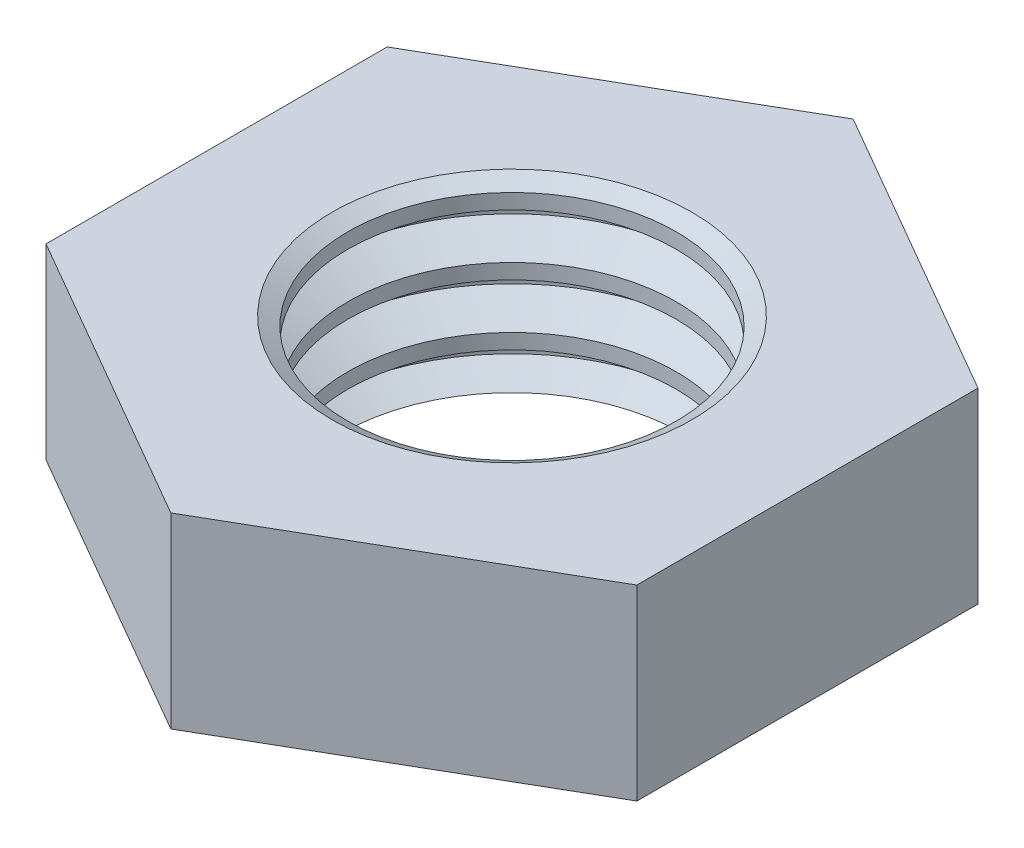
SolidWorks part; units mm, degrees
ref_plane "Front Plane" through (0, 0, 0) normal (0, 0, 1) x (1, 0, 0)
ref_plane "Top Plane" through (0, 0, 0) normal (0, 1, 0) x (1, 0, 0)
ref_plane "Right Plane" through (0, 0, 0) normal (1, 0, 0) x (0, 0, -1)
imported_body "Imported1"
sketch "Sketch1" plane through (0, 11.1125, 0) normal (0, 1, 0) x (1, 0, 0)
  circle A0 centre (0, 0) radius 20.0194
extrude "Cut-Extrude1" cut sketch "Sketch1" against normal blind 5.08
